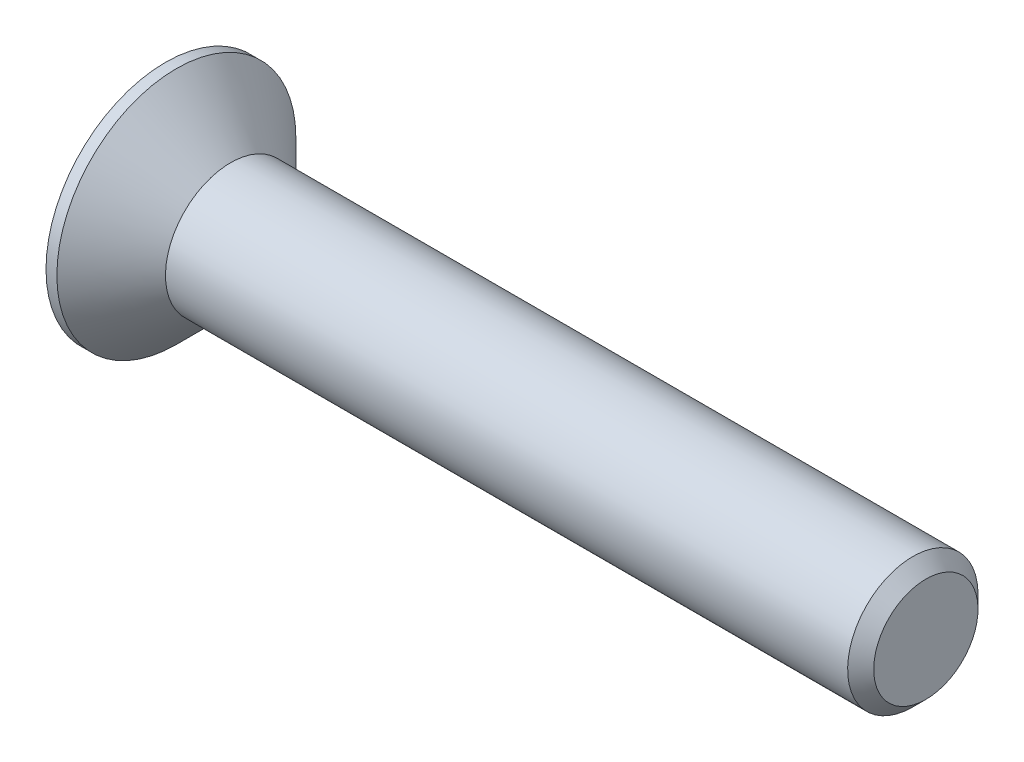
SolidWorks part; units mm, degrees
ref_plane "Front Plane" through (0, 0, 0) normal (0, 0, 1) x (1, 0, 0)
ref_plane "Top Plane" through (0, 0, 0) normal (0, 1, 0) x (1, 0, 0)
ref_plane "Right Plane" through (0, 0, 0) normal (1, 0, 0) x (0, 0, -1)
sketch "Sketch1" plane through (0, 0, 0) normal (0, 0, 1) x (1, 0, 0)
  line L1 (-3, 5.5) -> (-3, 0)
  line L2 (-3, 0) -> (32, 0)
  line L3 (32, 0) -> (32, 3)
  line L4 (32, 3) -> (0, 3)
  line L5 (-3, 5.5) -> (-2.5, 5.5)
  line L6 (-2.5, 5.5) -> (0, 3)
  dimension "D1" = 3
  dimension "D2" = 45
  dimension "D3" = 3
  dimension "D4" = 35
  dimension "D5" = 5.5
revolve "Revolve1" add sketch "Sketch1" angle 360 about L2
chamfer "Chamfer1" distance 0.6 angle 45 1 edges at (32, -3, 0)
sketch "Sketch2" plane through (-3, 0, 0) normal (-1, 0, 0) x (0, 0, 1)
  line L0 (-0.825, 3.3) -> (0.825, 3.3)
  line L1 (0.825, 3.3) -> (0.825, 0.825)
  line L2 (0.825, 0.825) -> (3.3, 0.825)
  line L3 (3.3, 0.825) -> (3.3, -0.825)
  line L4 (3.3, -0.825) -> (0.825, -0.825)
  line L5 (0.825, -0.825) -> (0.825, -3.3)
  line L6 (0.825, -3.3) -> (-0.825, -3.3)
  line L7 (-0.825, -3.3) -> (-0.825, -0.825)
  line L8 (-0.825, -0.825) -> (-3.3, -0.825)
  line L9 (-3.3, -0.825) -> (-3.3, 0.825)
  line L10 (-3.3, 0.825) -> (-0.825, 0.825)
  line L11 (-0.825, 0.825) -> (-0.825, 3.3)
  point P2 (0, 3.3)
  point P14 (0, -3.3)
  point P15 (3.3, 0)
  point P16 (-3.3, 0)
  dimension "D1" = 6.6
  dimension "D2" = 1.65
extrude "Cut-Extrude1" cut sketch "Sketch2" against normal blind 2.5
